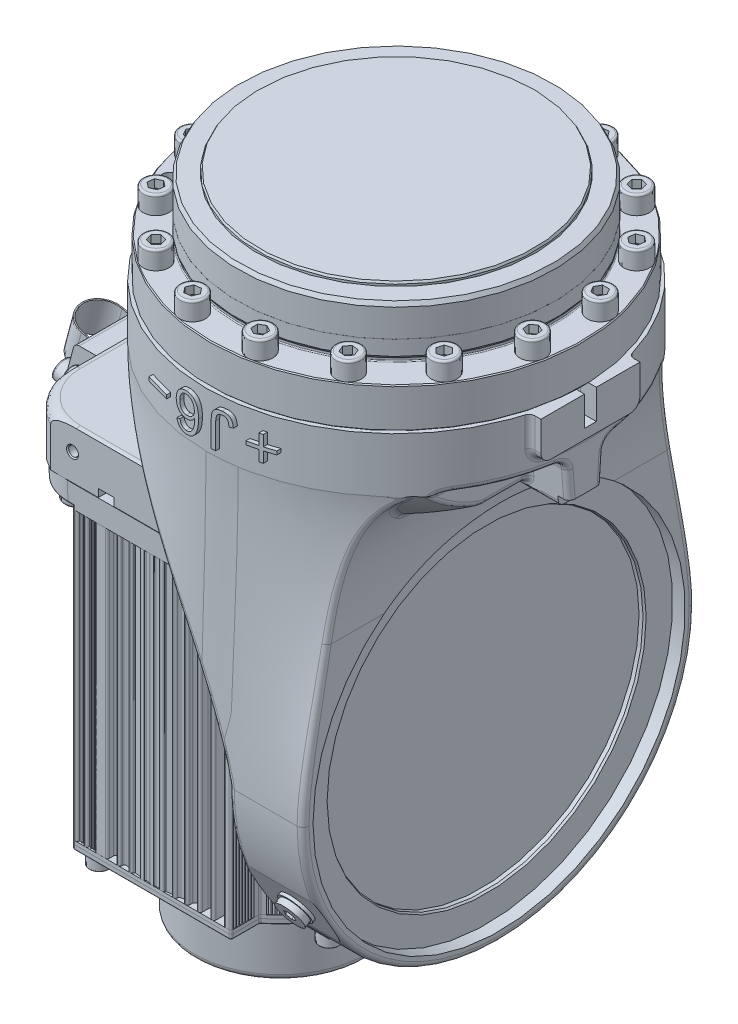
SolidWorks part; units mm, degrees
ref_plane "前视基准面" through (0, 0, 0) normal (0, 0, 1) x (1, 0, 0)
ref_plane "上视基准面" through (0, 0, 0) normal (0, 1, 0) x (1, 0, 0)
ref_plane "右视基准面" through (0, 0, 0) normal (1, 0, 0) x (0, 0, -1)
imported_body "腕部装配-1-solid1"
sketch "草图1" plane through (0, 43, 0) normal (0, -1, 0) x (1, 0, 0)
  line L0 (-123.5, -27) -> (-138.5, -27) construction
  line L1 (-123.5, 27) -> (-124.4955, 27)
  line L2 (-123.5, 27) -> (-123.5, -27)
  line L3 (-123.5, -27) -> (-124.4955, -27)
  line L4 (-124.4955, 27) -> (-124.4955, -27)
extrude "切除-拉伸1" cut sketch "草图1" against normal blind 25
sketch "草图2" plane through (0, 59.5, 0) normal (0, -1, 0) x (1, 0, 0)
  line L1 (6.8373, -65.9466) -> (-123.8373, -65.9466)
  line L2 (6.8373, -65.9466) -> (6.8373, 65.9466)
  line L3 (6.8373, 65.9466) -> (-123.8373, 65.9466)
  line L4 (-123.8373, -65.9466) -> (-123.8373, 65.9466)
  line L5 (6.8373, -65.9466) -> (-123.8373, 65.9466) construction
  line L6 (6.8373, 65.9466) -> (-123.8373, -65.9466) construction
  point P0 (-58.5, 0)
surface "曲面-基准面1" sketch "草图2"
split "分割1" trim tools "曲面-基准面1" bodies to split 123 resulting bodies 125 126
